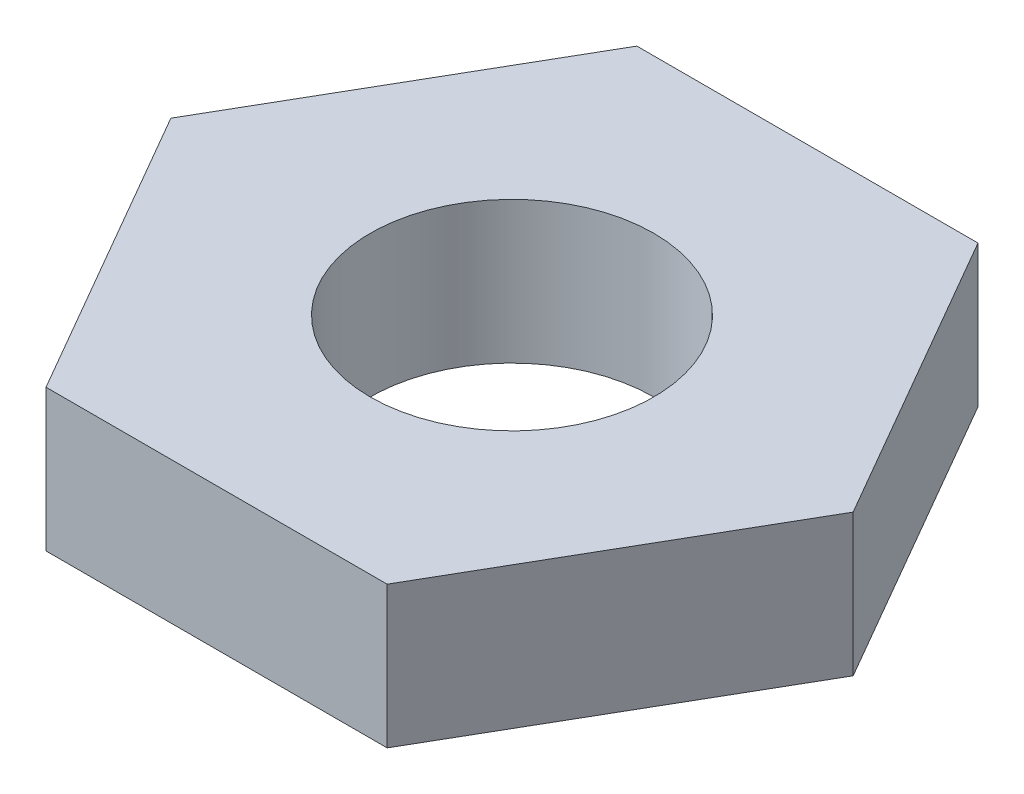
SolidWorks part; units mm, degrees
ref_plane "Front" through (0, 0, 0) normal (0, 0, 1) x (1, 0, 0)
ref_plane "Top" through (0, 0, 0) normal (0, 1, 0) x (1, 0, 0)
ref_plane "Right" through (0, 0, 0) normal (1, 0, 0) x (0, 0, -1)
sketch "Sketch1" plane through (0, 0, 0) normal (0, 1, 0) x (1, 0, 0)
  line L1 (14.4338, 0) -> (7.2169, 12.5)
  line L2 (7.2169, 12.5) -> (-7.2169, 12.5)
  line L3 (-7.2169, 12.5) -> (-14.4338, 0)
  line L4 (-14.4338, 0) -> (-7.2169, -12.5)
  line L5 (-7.2169, -12.5) -> (7.2169, -12.5)
  line L6 (7.2169, -12.5) -> (14.4338, 0)
  circle A0 centre (0, 0) radius 12.5 construction
  circle A1 centre (0, 0) radius 6
extrude "Extrude1" add sketch "Sketch1" along normal blind 6
